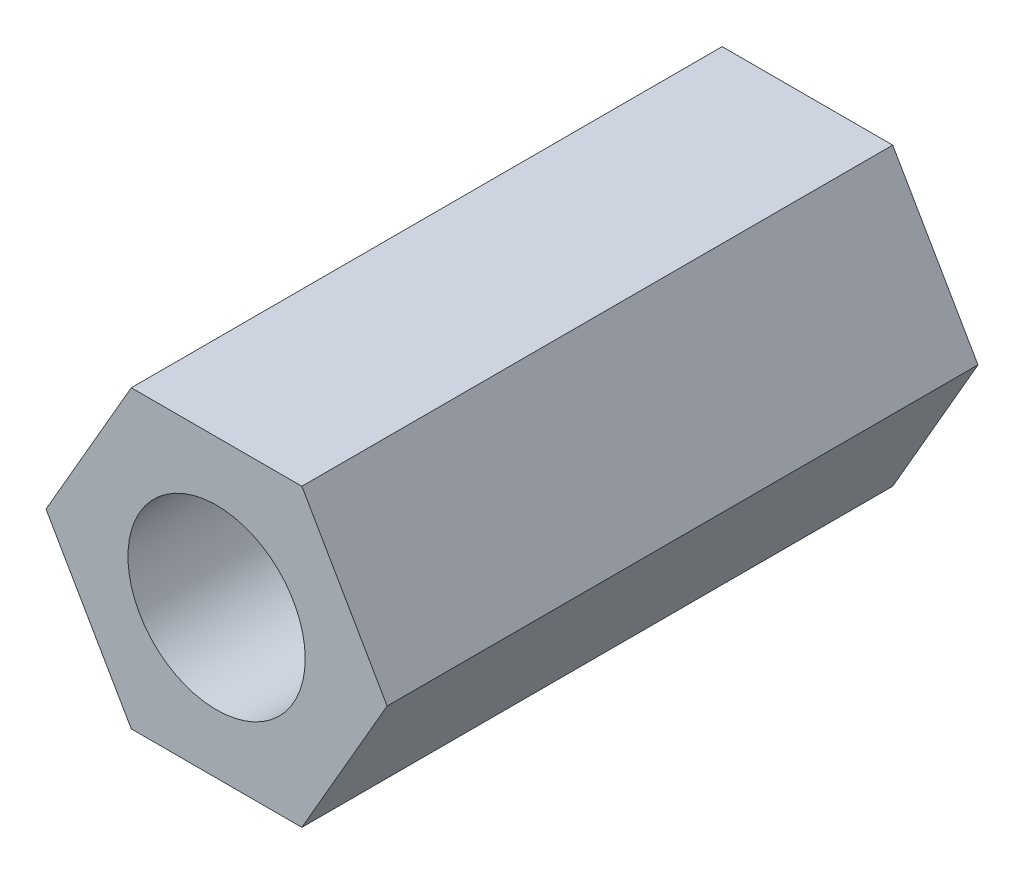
SolidWorks part; units mm, degrees
ref_plane "Face" through (0, 0, 0) normal (0, 0, 1) x (1, 0, 0)
ref_plane "Dessus" through (0, 0, 0) normal (0, 1, 0) x (1, 0, 0)
ref_plane "Droite" through (0, 0, 0) normal (1, 0, 0) x (0, 0, -1)
sketch "Esquisse1" plane through (0, 0, 0) normal (0, 0, 1) x (1, 0, 0)
  line L1 (2.8868, 0) -> (1.4434, 2.5)
  line L2 (1.4434, 2.5) -> (-1.4434, 2.5)
  line L3 (-1.4434, 2.5) -> (-2.8868, 0)
  line L4 (-2.8868, 0) -> (-1.4434, -2.5)
  line L5 (-1.4434, -2.5) -> (1.4434, -2.5)
  line L6 (1.4434, -2.5) -> (2.8868, 0)
  circle A0 centre (0, 0) radius 2.5 construction
  circle A1 centre (0, 0) radius 1.5
  dimension "D1" = 5
  dimension "D2" = 3
extrude "Extrusion1" add sketch "Esquisse1" along normal blind 10
